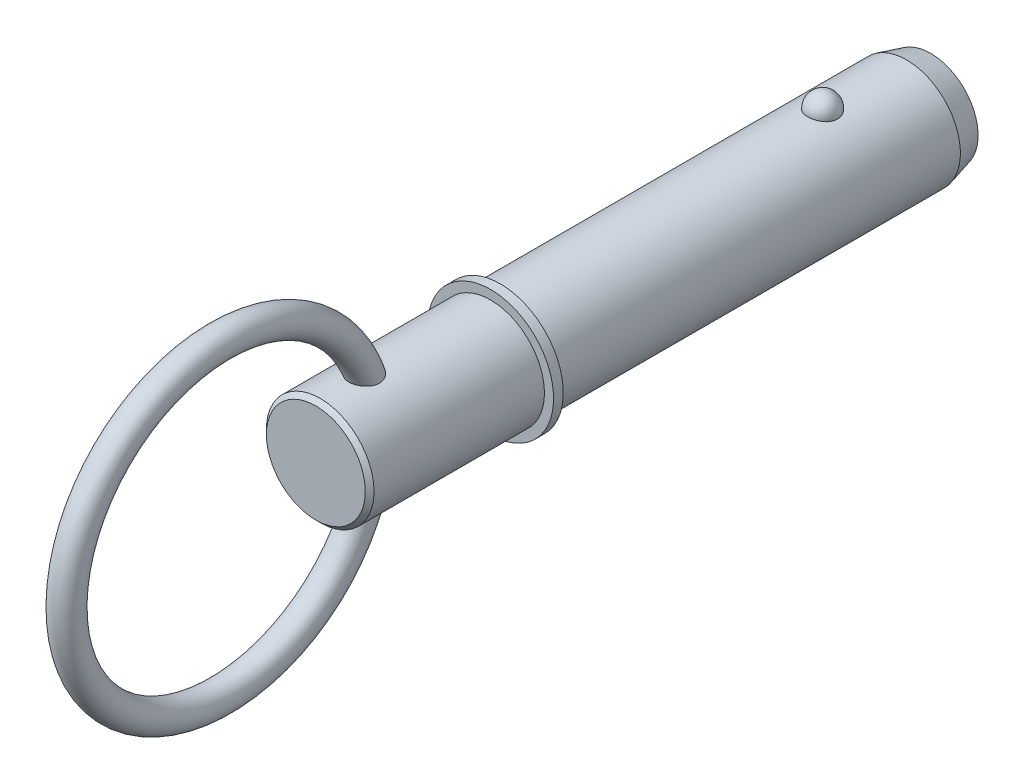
SolidWorks part; units mm, degrees
ref_plane "Front Plane" through (0, 0, 0) normal (0, 0, 1) x (1, 0, 0)
ref_plane "Top Plane" through (0, 0, 0) normal (0, 1, 0) x (1, 0, 0)
ref_plane "Right Plane" through (0, 0, 0) normal (1, 0, 0) x (0, 0, -1)
sketch "Sketch2" plane through (0, 0, 0) normal (0, 0, 1) x (1, 0, 0)
  circle A0 centre (0, 0) radius 11.115
  point P3 (0, 11.115)
  dimension "D1" = 22.23
extrude "Boss-Extrude1" add sketch "Sketch2" along normal blind 63.5
sketch "Sketch3" plane through (0, 0, 0) normal (0, 0, -1) x (-1, 0, 0)
  circle A0 centre (0, 0) radius 11.115
  dimension "D1" = 22.23
extrude "Boss-Extrude2" add sketch "Sketch3" along normal blind 25.4
chamfer "Chamfer1" distance 5 angle 15 1 edges at (-11.115, 0, -25.4)
sketch "Sketch18" plane through (0, 0, 0) normal (1, 0, 0) x (0, 0, -1)
  line L0 (20.4, 11.115) -> (-63.5, 11.115) construction
  line L1 (3.07, 14.185) -> (3.07, 8.045)
  line L2 (-63.5, -11.115) -> (20.4, -11.115) construction
  arc A0 (3.07, 14.185) -> (3.07, 8.045) centre (3.07, 11.115) ccw
  point P4 (0, 11.115)
  dimension "D1" = 25.3
revolve "Revolve1" add sketch "Sketch18" angle 360 about L1
sketch "Sketch19" plane through (0, 0, 0) normal (1, 0, 0) x (0, 0, -1)
  line L0 (-33.7288, 0) -> (-46.4542, 0) construction
sketch "Sketch20" plane through (0, 0, 0) normal (1, 0, 0) x (0, 0, -1)
  line L0 (-63.5, 0) -> (-63.5, 13)
  line L1 (-63.5, 11.115) -> (-63.5, -11.115) construction
  line L2 (-63.5, 13) -> (-65.5, 13)
  line L3 (-65.5, 13) -> (-65.5, 0)
  line L4 (-33.7288, 0) -> (-46.4542, 0) construction
  line L5 (-65.5, 0) -> (-63.5, 0)
  dimension "D1" = 13
  dimension "D2" = 2
revolve "Revolve2" add sketch "Sketch20" angle 360 about L0
sketch "Sketch21" plane through (0, 0, 63.5) normal (0, 0, -1) x (-1, 0, 0)
  circle A0 centre (0, 0) radius 11.115
  dimension "D1" = 22.23
extrude "Boss-Extrude3" add sketch "Sketch21" against normal blind 38.1
chamfer "Chamfer2" distance 0.9 angle 45 1 edges at (-11.115, 0, 101.6)
sketch "Sketch23" plane through (0, 0, 0) normal (1, 0, 0) x (0, 0, -1)
  line L0 (-101.6, 10.215) -> (-101.6, -10.215) construction
  circle A0 centre (-121.35, 0) radius 31.75
  point P2 (-89.6, 0)
  dimension "D1" = 63.5
  dimension "D2" = 12
sketch "Sketch24" plane through (0, 0, 0) normal (0, 1, 0) x (1, 0, 0)
  circle A0 centre (0, -89.6) radius 3
  dimension "D1" = 6
sweep "Sweep1" add profiles "Sketch24" path "Sketch23"
